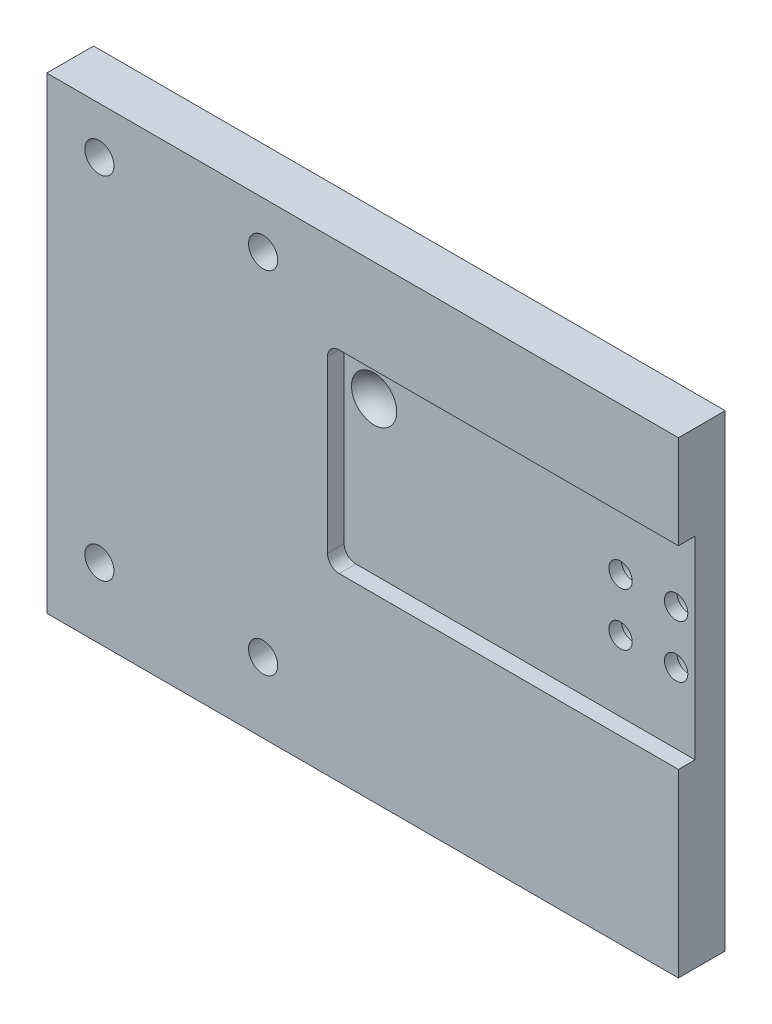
SolidWorks part; units mm, degrees
ref_plane "Front Plane" through (0, 0, 0) normal (0, 0, 1) x (1, 0, 0)
ref_plane "Top Plane" through (0, 0, 0) normal (0, 1, 0) x (1, 0, 0)
ref_plane "Right Plane" through (0, 0, 0) normal (1, 0, 0) x (0, 0, -1)
sketch "Sketch1" plane through (0, 0, 0) normal (0, 0, 1) x (1, 0, 0)
  line L0 (0, 0) -> (171.45, 0)
  line L1 (171.45, 0) -> (171.45, 127)
  line L2 (171.45, 127) -> (0, 127)
  line L3 (0, 127) -> (0, 0)
  line L4 (171.45, 49.022) -> (76.2, 49.022)
  line L5 (76.2, 49.022) -> (76.2, 101.6)
  line L6 (76.2, 101.6) -> (171.45, 101.6)
  line L7 (50.0126, 0) -> (50.0126, 15.24) construction
  line L8 (75.4126, 0) -> (75.4126, 15.24) construction
  line L9 (100.8126, 0) -> (100.8126, 15.24) construction
  line L10 (126.2126, 0) -> (126.2126, 15.24) construction
  line L11 (50.0126, 15.24) -> (75.4126, 15.24) construction
  line L12 (75.4126, 15.24) -> (100.8126, 15.24) construction
  line L13 (100.8126, 15.24) -> (126.2126, 15.24) construction
  line L14 (76.2, 75.311) -> (120.8002, 75.311) construction
  line L15 (88.1126, 15.24) -> (88.1126, 0) construction
  circle A0 centre (14.2748, 114.3) radius 3.9624
  circle A1 centre (58.7248, 114.3) radius 3.9624
  circle A2 centre (14.2748, 19.05) radius 3.9624
  circle A3 centre (58.7248, 19.05) radius 3.9624
  circle A4 centre (166.2938, 82.4484) radius 3.175
  circle A5 centre (166.2938, 68.1736) radius 3.175
  circle A6 centre (151.2062, 68.1736) radius 3.175
  circle A7 centre (151.2062, 82.4484) radius 3.175
  circle A8 centre (166.2938, 82.4484) radius 4.7625
  circle A9 centre (166.2938, 68.1736) radius 4.7625
  circle A10 centre (151.2062, 68.1736) radius 4.7625
  circle A11 centre (151.2062, 82.4484) radius 4.7625
  circle A12 centre (84.328, 90.3097) radius 7.62
  circle A13 centre (84.328, 60.3123) radius 7.62
  dimension "D6" = 7.9248
  dimension "D13" = 6.35
  dimension "D18" = 9.525
  dimension "D21" = 15.24
  dimension "D1" = 171.45
  dimension "D2" = 127
  dimension "D3" = 49.022
  dimension "D4" = 52.578
  dimension "D5" = 95.25
  dimension "D7" = 12.7
  dimension "D8" = 95.25
  dimension "D9" = 14.2748
  dimension "D10" = 44.45
  dimension "D11" = 25.4
  dimension "D12" = 88.1126
  dimension "D14" = 14.2748
  dimension "D15" = 15.0876
  dimension "D16" = 5.1562
  dimension "D17" = 15.24
  dimension "D19" = 29.9974
  dimension "D20" = 66.8782
sketch "Sketch2" plane through (0, 0, 0) normal (0, 0, 1) x (1, 0, 0)
  line L0 (0, 0) -> (171.45, 0) construction
  line L1 (171.45, 0) -> (171.45, 127) construction
  line L2 (171.45, 127) -> (0, 127) construction
  line L3 (0, 127) -> (0, 0) construction
  line L4 (0, 0) -> (171.45, 0)
  line L5 (171.45, 0) -> (171.45, 127)
  line L6 (171.45, 127) -> (0, 127)
  line L7 (0, 127) -> (0, 0)
  circle A0 centre (14.2748, 19.05) radius 3.9624 construction
  circle A1 centre (58.7248, 19.05) radius 3.9624 construction
  circle A2 centre (58.7248, 114.3) radius 3.9624 construction
  circle A3 centre (14.2748, 114.3) radius 3.9624 construction
  circle A4 centre (14.2748, 19.05) radius 3.9624
  circle A5 centre (58.7248, 19.05) radius 3.9624
  circle A6 centre (58.7248, 114.3) radius 3.9624
  circle A7 centre (14.2748, 114.3) radius 3.9624
  circle A8 centre (151.2062, 68.1736) radius 3.175 construction
  circle A9 centre (166.2938, 68.1736) radius 3.175 construction
  circle A10 centre (166.2938, 82.4484) radius 3.175 construction
  circle A11 centre (151.2062, 82.4484) radius 3.175 construction
  circle A12 centre (151.2062, 68.1736) radius 3.175
  circle A13 centre (166.2938, 68.1736) radius 3.175
  circle A14 centre (166.2938, 82.4484) radius 3.175
  circle A15 centre (151.2062, 82.4484) radius 3.175
extrude "Boss-Extrude1" add sketch "Sketch2" along normal mid plane 12.7
sketch "Sketch3" plane through (0, 0, 0) normal (0, -1, 0) x (1, 0, 0)
  circle A0 centre (50.0126, 0) radius 3.175
  circle A1 centre (75.4126, 0) radius 3.175
  circle A2 centre (100.8126, 0) radius 3.175
  circle A3 centre (126.2126, 0) radius 3.175
  dimension "D1" = 6.35
extrude "Cut-Extrude1" cut sketch "Sketch3" against normal blind 15.875
sketch "Sketch4" plane through (0, 0, 6.35) normal (0, 0, 1) x (1, 0, 0)
  line L0 (171.45, 49.022) -> (76.2, 49.022) construction
  line L1 (76.2, 101.6) -> (171.45, 101.6) construction
  line L2 (76.2, 49.022) -> (76.2, 101.6) construction
  line L3 (171.45, 0) -> (171.45, 127) construction
  line L4 (171.45, 49.022) -> (76.2, 49.022)
  line L5 (76.2, 101.6) -> (171.45, 101.6)
  line L6 (76.2, 49.022) -> (76.2, 101.6)
  line L7 (171.45, 49.022) -> (171.45, 101.6)
extrude "Cut-Extrude2" cut sketch "Sketch4" against normal blind 4.5212
fillet "Fillet1" radius 3.175 2 edges at (76.2, 49.022, 4.0894) (76.2, 101.6, 4.0894)
sketch "Sketch6" plane through (0, 0, -6.35) normal (0, 0, -1) x (-1, 0, 0)
  circle A0 centre (-151.2062, 68.1736) radius 4.7625 construction
  circle A1 centre (-166.2938, 68.1736) radius 4.7625 construction
  circle A2 centre (-166.2938, 82.4484) radius 4.7625 construction
  circle A3 centre (-151.2062, 82.4484) radius 4.7625 construction
  circle A4 centre (-151.2062, 68.1736) radius 4.7625
  circle A5 centre (-166.2938, 68.1736) radius 4.7625
  circle A6 centre (-166.2938, 82.4484) radius 4.7625
  circle A7 centre (-151.2062, 82.4484) radius 4.7625
extrude "Cut-Extrude3" cut sketch "Sketch6" against normal blind 4.7752
sketch "Sketch8" plane through (0, 0, 0) normal (0, -1, 0) x (1, 0, 0)
  line L0 (88.1126, 0) -> (88.1126, 6.35)
  line L1 (0, 6.35) -> (171.45, 6.35) construction
chamfer "Chamfer1" distance 1.778 angle 59 4 edges at (126.2126, 15.875, -3.175) (100.8126, 15.875, -3.175) (75.4126, 15.875, -3.175) (50.0126, 15.875, -3.175)
sketch "Sketch10" plane through (0, 0, 6.35) normal (0, 0, 1) x (1, 0, 0)
  line L0 (76.708, 90.3097) -> (91.948, 90.3097)
  circle A0 centre (84.328, 90.3097) radius 7.62 construction
  arc A2 (91.948, 90.3097) -> (76.708, 90.3097) centre (84.328, 90.3097) ccw
revolve "Cut-Revolve1" cut sketch "Sketch10" angle 360 about L0
